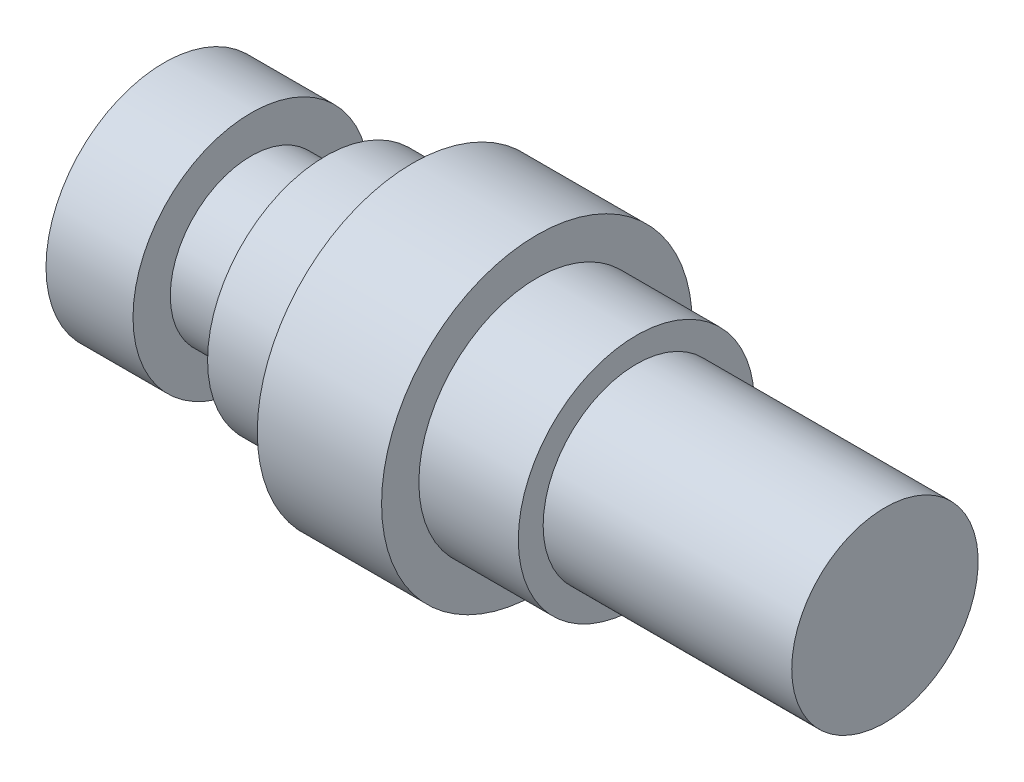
SolidWorks part; units mm, degrees
ref_plane "Front Plane" through (0, 0, 0) normal (0, 0, 1) x (1, 0, 0)
ref_plane "Top Plane" through (0, 0, 0) normal (0, 1, 0) x (1, 0, 0)
ref_plane "Right Plane" through (0, 0, 0) normal (1, 0, 0) x (0, 0, -1)
sketch "Sketch1" plane through (0, 0, 0) normal (0, 0, 1) x (1, 0, 0)
  line L0 (-78.0244, 0) -> (53.439, 0) construction
  line L1 (-70.6829, 0) -> (-70.6829, 9.5)
  line L2 (-70.6829, 9.5) -> (-63.6829, 9.5)
  line L3 (-63.6829, 9.5) -> (-63.6829, 6.5)
  line L4 (-63.6829, 6.5) -> (-57.6829, 6.5)
  line L5 (-57.6829, 6.5) -> (-57.6829, 9.5)
  line L6 (-57.6829, 9.5) -> (-50.6829, 9.5)
  line L7 (-50.6829, 9.5) -> (-50.6829, 12.5)
  line L8 (-50.6829, 12.5) -> (-40.6829, 12.5)
  line L9 (-40.6829, 12.5) -> (-40.6829, 9.5)
  line L10 (-40.6829, 9.5) -> (-32.6829, 9.5)
  line L11 (-12.6829, 7.5) -> (-12.6829, 0)
  line L12 (-12.6829, 0) -> (-70.6829, 0)
  line L13 (-32.6829, 9.5) -> (-32.6829, 7.5)
  line L14 (-32.6829, 7.5) -> (-12.6829, 7.5)
  dimension "D1" = 7
  dimension "D2" = 7
  dimension "D3" = 6
  dimension "D4" = 10
  dimension "D5" = 15
  dimension "D6" = 19
  dimension "D7" = 13
  dimension "D8" = 25
  dimension "D9" = 19
  dimension "D10" = 8
  dimension "D11" = 20
revolve "Revolve1" add sketch "Sketch1" angle 360 about L0
